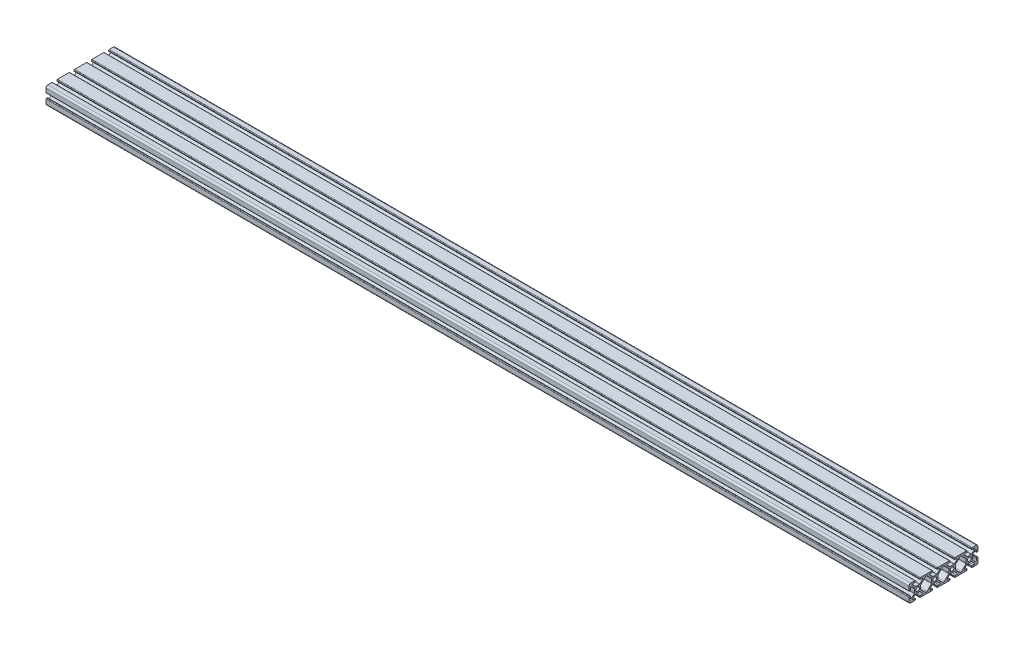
SolidWorks part; units mm, degrees
ref_plane "Ebene vorne" through (0, 0, 0) normal (0, 0, 1) x (1, 0, 0)
ref_plane "Ebene oben" through (0, 0, 0) normal (0, 1, 0) x (1, 0, 0)
ref_plane "Ebene rechts" through (0, 0, 0) normal (1, 0, 0) x (0, 0, -1)
sketch "Skizze3" plane through (0, 0, 0) normal (0, 1, 0) x (1, 0, 0)
  line L0 (0, 0) -> (1000, 0)
  dimension "D1" = 1000
other "Strukturbauteil1"
ref_plane "Ebene1" through (0, 0, 0) normal (1, 0, 0) x (0, 0, -1)
sketch "Model" plane through (0, 0, 0) normal (1, 0, 0) x (0, 0, -1)
  line L0 (-26.35, -2.0337) -> (-26.35, 2.0337)
  line L1 (-26.0571, 2.7408) -> (-21.0207, 7.7772)
  line L2 (-18.9793, 7.7772) -> (-13.9429, 2.7408)
  line L3 (-13.65, 2.0337) -> (-13.65, -2.0337)
  line L4 (-13.9429, -2.7408) -> (-18.9793, -7.7772)
  line L5 (-21.0207, -7.7772) -> (-26.0571, -2.7408)
  line L6 (-40, -3.2) -> (-40, -8)
  line L7 (-38, -10) -> (-33.2, -10)
  line L8 (-32.5, -9.3) -> (-32.5, -8.7)
  line L9 (-33, -8.2) -> (-34.8676, -8.2)
  line L10 (-35.4915, -6.6936) -> (-32.7408, -3.9429)
  line L11 (-32.0337, -3.65) -> (-27.9663, -3.65)
  line L12 (-27.2592, -3.9429) -> (-24.5085, -6.6936)
  line L13 (-25.1324, -8.2) -> (-27, -8.2)
  line L14 (-27.5, -8.7) -> (-27.5, -9.3)
  line L15 (-26.8, -10) -> (-13.2, -10)
  line L16 (-12.5, -9.3) -> (-12.5, -8.7)
  line L17 (-13, -8.2) -> (-14.8676, -8.2)
  line L18 (-15.4915, -6.6936) -> (-12.7408, -3.9429)
  line L19 (-12.0337, -3.65) -> (-7.9663, -3.65)
  line L20 (-7.2592, -3.9429) -> (-4.5085, -6.6936)
  line L21 (-5.1324, -8.2) -> (-7, -8.2)
  line L22 (-7.5, -8.7) -> (-7.5, -9.3)
  line L23 (-6.8, -10) -> (6.8, -10)
  line L24 (7.5, -9.3) -> (7.5, -8.7)
  line L25 (7, -8.2) -> (5.1324, -8.2)
  line L26 (4.5085, -6.6936) -> (7.2592, -3.9429)
  line L27 (7.9663, -3.65) -> (12.0337, -3.65)
  line L28 (12.7408, -3.9429) -> (15.4915, -6.6936)
  line L29 (14.8676, -8.2) -> (13, -8.2)
  line L30 (12.5, -8.7) -> (12.5, -9.3)
  line L31 (13.2, -10) -> (26.8, -10)
  line L32 (27.5, -9.3) -> (27.5, -8.7)
  line L33 (27, -8.2) -> (25.1324, -8.2)
  line L34 (24.5085, -6.6936) -> (27.2592, -3.9429)
  line L35 (27.9663, -3.65) -> (32.0337, -3.65)
  line L36 (32.7408, -3.9429) -> (35.4915, -6.6936)
  line L37 (34.8676, -8.2) -> (33, -8.2)
  line L38 (32.5, -8.7) -> (32.5, -9.3)
  line L39 (33.2, -10) -> (38, -10)
  line L40 (40, -8) -> (40, -3.2)
  line L41 (39.3, -2.5) -> (38.7, -2.5)
  line L42 (38.2, -3) -> (38.2, -4.8676)
  line L43 (36.6936, -5.4915) -> (33.9429, -2.7408)
  line L44 (33.65, -2.0337) -> (33.65, 2.0337)
  line L45 (33.9429, 2.7408) -> (36.6936, 5.4915)
  line L46 (38.2, 4.8676) -> (38.2, 3)
  line L47 (38.7, 2.5) -> (39.3, 2.5)
  line L48 (40, 3.2) -> (40, 8)
  line L49 (38, 10) -> (33.2, 10)
  line L50 (32.5, 9.3) -> (32.5, 8.7)
  line L51 (33, 8.2) -> (34.8676, 8.2)
  line L52 (35.4915, 6.6936) -> (32.7408, 3.9429)
  line L53 (32.0337, 3.65) -> (27.9663, 3.65)
  line L54 (27.2592, 3.9429) -> (24.5085, 6.6936)
  line L55 (25.1324, 8.2) -> (27, 8.2)
  line L56 (27.5, 8.7) -> (27.5, 9.3)
  line L57 (26.8, 10) -> (13.2, 10)
  line L58 (12.5, 9.3) -> (12.5, 8.7)
  line L59 (13, 8.2) -> (14.8676, 8.2)
  line L60 (15.4915, 6.6936) -> (12.7408, 3.9429)
  line L61 (12.0337, 3.65) -> (7.9663, 3.65)
  line L62 (7.2592, 3.9429) -> (4.5085, 6.6936)
  line L63 (5.1324, 8.2) -> (7, 8.2)
  line L64 (7.5, 8.7) -> (7.5, 9.3)
  line L65 (6.8, 10) -> (-6.8, 10)
  line L66 (-7.5, 9.3) -> (-7.5, 8.7)
  line L67 (-7, 8.2) -> (-5.1324, 8.2)
  line L68 (-4.5085, 6.6936) -> (-7.2592, 3.9429)
  line L69 (-7.9663, 3.65) -> (-12.0337, 3.65)
  line L70 (-12.7408, 3.9429) -> (-15.4915, 6.6936)
  line L71 (-14.8676, 8.2) -> (-13, 8.2)
  line L72 (-12.5, 8.7) -> (-12.5, 9.3)
  line L73 (-13.2, 10) -> (-26.8, 10)
  line L74 (-27.5, 9.3) -> (-27.5, 8.7)
  line L75 (-27, 8.2) -> (-25.1324, 8.2)
  line L76 (-24.5085, 6.6936) -> (-27.2592, 3.9429)
  line L77 (-27.9663, 3.65) -> (-32.0337, 3.65)
  line L78 (-32.7408, 3.9429) -> (-35.4915, 6.6936)
  line L79 (-34.8676, 8.2) -> (-33, 8.2)
  line L80 (-32.5, 8.7) -> (-32.5, 9.3)
  line L81 (-33.2, 10) -> (-38, 10)
  line L82 (-40, 8) -> (-40, 3.2)
  line L83 (-39.3, 2.5) -> (-38.7, 2.5)
  line L84 (-38.2, 3) -> (-38.2, 4.8676)
  line L85 (-36.6936, 5.4915) -> (-33.9429, 2.7408)
  line L86 (-33.65, 2.0337) -> (-33.65, -2.0337)
  line L87 (-33.9429, -2.7408) -> (-36.6936, -5.4915)
  line L88 (-38.2, -4.8676) -> (-38.2, -3)
  line L89 (-38.7, -2.5) -> (-39.3, -2.5)
  line L90 (13.65, -2.0337) -> (13.65, 2.0337)
  line L91 (13.9429, 2.7408) -> (18.9793, 7.7772)
  line L92 (21.0207, 7.7772) -> (26.0571, 2.7408)
  line L93 (26.35, 2.0337) -> (26.35, -2.0337)
  line L94 (26.0571, -2.7408) -> (21.0207, -7.7772)
  line L95 (18.9793, -7.7772) -> (13.9429, -2.7408)
  line L96 (-6.35, -2.0337) -> (-6.35, 2.0337)
  line L97 (-6.0571, 2.7408) -> (-1.0207, 7.7772)
  line L98 (1.0207, 7.7772) -> (6.0571, 2.7408)
  line L99 (6.35, 2.0337) -> (6.35, -2.0337)
  line L100 (6.0571, -2.7408) -> (1.0207, -7.7772)
  line L101 (-1.0207, -7.7772) -> (-6.0571, -2.7408)
  line L103 (-40, 10) -> (40, 10) construction
  line L104 (-40, 10) -> (-40, -10) construction
  line L105 (-40, -10) -> (40, -10) construction
  line L106 (40, 10) -> (40, -10) construction
  line L107 (-40, 10) -> (40, -10) construction
  line L108 (-40, -10) -> (40, 10) construction
  circle A0 centre (-30, 0) radius 2.15
  circle A1 centre (-10, 0) radius 2.15
  circle A2 centre (30, 0) radius 2.15
  circle A3 centre (10, 0) radius 2.15
  arc A4 (-26.35, -2.0337) -> (-26.0571, -2.7408) centre (-25.35, -2.0337) ccw
  arc A5 (-26.0571, 2.7408) -> (-26.35, 2.0337) centre (-25.35, 2.0337) ccw
  arc A6 (-18.9793, 7.7772) -> (-21.0207, 7.7772) centre (-20, 6.7565) ccw
  arc A7 (-13.65, 2.0337) -> (-13.9429, 2.7408) centre (-14.65, 2.0337) ccw
  arc A8 (-13.9429, -2.7408) -> (-13.65, -2.0337) centre (-14.65, -2.0337) ccw
  arc A9 (-21.0207, -7.7772) -> (-18.9793, -7.7772) centre (-20, -6.7565) ccw
  arc A10 (-40, -8) -> (-38, -10) centre (-38, -8) ccw
  arc A11 (-33.2, -10) -> (-32.5, -9.3) centre (-33.2, -9.3) ccw
  arc A12 (-32.5, -8.7) -> (-33, -8.2) centre (-33, -8.7) ccw
  arc A13 (-35.4915, -6.6936) -> (-34.8676, -8.2) centre (-34.8676, -7.3176) ccw
  arc A14 (-32.0337, -3.65) -> (-32.7408, -3.9429) centre (-32.0337, -4.65) ccw
  arc A15 (-27.2592, -3.9429) -> (-27.9663, -3.65) centre (-27.9663, -4.65) ccw
  arc A16 (-25.1324, -8.2) -> (-24.5085, -6.6936) centre (-25.1324, -7.3176) ccw
  arc A17 (-27, -8.2) -> (-27.5, -8.7) centre (-27, -8.7) ccw
  arc A18 (-27.5, -9.3) -> (-26.8, -10) centre (-26.8, -9.3) ccw
  arc A19 (-13.2, -10) -> (-12.5, -9.3) centre (-13.2, -9.3) ccw
  arc A20 (-12.5, -8.7) -> (-13, -8.2) centre (-13, -8.7) ccw
  arc A21 (-15.4915, -6.6936) -> (-14.8676, -8.2) centre (-14.8676, -7.3176) ccw
  arc A22 (-12.0337, -3.65) -> (-12.7408, -3.9429) centre (-12.0337, -4.65) ccw
  arc A23 (-7.2592, -3.9429) -> (-7.9663, -3.65) centre (-7.9663, -4.65) ccw
  arc A24 (-5.1324, -8.2) -> (-4.5085, -6.6936) centre (-5.1324, -7.3176) ccw
  arc A25 (-7, -8.2) -> (-7.5, -8.7) centre (-7, -8.7) ccw
  arc A26 (-7.5, -9.3) -> (-6.8, -10) centre (-6.8, -9.3) ccw
  arc A27 (6.8, -10) -> (7.5, -9.3) centre (6.8, -9.3) ccw
  arc A28 (7.5, -8.7) -> (7, -8.2) centre (7, -8.7) ccw
  arc A29 (4.5085, -6.6936) -> (5.1324, -8.2) centre (5.1324, -7.3176) ccw
  arc A30 (7.9663, -3.65) -> (7.2592, -3.9429) centre (7.9663, -4.65) ccw
  arc A31 (12.7408, -3.9429) -> (12.0337, -3.65) centre (12.0337, -4.65) ccw
  arc A32 (14.8676, -8.2) -> (15.4915, -6.6936) centre (14.8676, -7.3176) ccw
  arc A33 (13, -8.2) -> (12.5, -8.7) centre (13, -8.7) ccw
  arc A34 (12.5, -9.3) -> (13.2, -10) centre (13.2, -9.3) ccw
  arc A35 (26.8, -10) -> (27.5, -9.3) centre (26.8, -9.3) ccw
  arc A36 (27.5, -8.7) -> (27, -8.2) centre (27, -8.7) ccw
  arc A37 (24.5085, -6.6936) -> (25.1324, -8.2) centre (25.1324, -7.3176) ccw
  arc A38 (27.9663, -3.65) -> (27.2592, -3.9429) centre (27.9663, -4.65) ccw
  arc A39 (32.7408, -3.9429) -> (32.0337, -3.65) centre (32.0337, -4.65) ccw
  arc A40 (34.8676, -8.2) -> (35.4915, -6.6936) centre (34.8676, -7.3176) ccw
  arc A41 (33, -8.2) -> (32.5, -8.7) centre (33, -8.7) ccw
  arc A42 (32.5, -9.3) -> (33.2, -10) centre (33.2, -9.3) ccw
  arc A43 (38, -10) -> (40, -8) centre (38, -8) ccw
  arc A44 (40, -3.2) -> (39.3, -2.5) centre (39.3, -3.2) ccw
  arc A45 (38.7, -2.5) -> (38.2, -3) centre (38.7, -3) ccw
  arc A46 (36.6936, -5.4915) -> (38.2, -4.8676) centre (37.3176, -4.8676) ccw
  arc A47 (33.65, -2.0337) -> (33.9429, -2.7408) centre (34.65, -2.0337) ccw
  arc A48 (33.9429, 2.7408) -> (33.65, 2.0337) centre (34.65, 2.0337) ccw
  arc A49 (38.2, 4.8676) -> (36.6936, 5.4915) centre (37.3176, 4.8676) ccw
  arc A50 (38.2, 3) -> (38.7, 2.5) centre (38.7, 3) ccw
  arc A51 (39.3, 2.5) -> (40, 3.2) centre (39.3, 3.2) ccw
  arc A52 (40, 8) -> (38, 10) centre (38, 8) ccw
  arc A53 (33.2, 10) -> (32.5, 9.3) centre (33.2, 9.3) ccw
  arc A54 (32.5, 8.7) -> (33, 8.2) centre (33, 8.7) ccw
  arc A55 (35.4915, 6.6936) -> (34.8676, 8.2) centre (34.8676, 7.3176) ccw
  arc A56 (32.0337, 3.65) -> (32.7408, 3.9429) centre (32.0337, 4.65) ccw
  arc A57 (27.2592, 3.9429) -> (27.9663, 3.65) centre (27.9663, 4.65) ccw
  arc A58 (25.1324, 8.2) -> (24.5085, 6.6936) centre (25.1324, 7.3176) ccw
  arc A59 (27, 8.2) -> (27.5, 8.7) centre (27, 8.7) ccw
  arc A60 (27.5, 9.3) -> (26.8, 10) centre (26.8, 9.3) ccw
  arc A61 (13.2, 10) -> (12.5, 9.3) centre (13.2, 9.3) ccw
  arc A62 (12.5, 8.7) -> (13, 8.2) centre (13, 8.7) ccw
  arc A63 (15.4915, 6.6936) -> (14.8676, 8.2) centre (14.8676, 7.3176) ccw
  arc A64 (12.0337, 3.65) -> (12.7408, 3.9429) centre (12.0337, 4.65) ccw
  arc A65 (7.2592, 3.9429) -> (7.9663, 3.65) centre (7.9663, 4.65) ccw
  arc A66 (5.1324, 8.2) -> (4.5085, 6.6936) centre (5.1324, 7.3176) ccw
  arc A67 (7, 8.2) -> (7.5, 8.7) centre (7, 8.7) ccw
  arc A68 (7.5, 9.3) -> (6.8, 10) centre (6.8, 9.3) ccw
  arc A69 (-6.8, 10) -> (-7.5, 9.3) centre (-6.8, 9.3) ccw
  arc A70 (-7.5, 8.7) -> (-7, 8.2) centre (-7, 8.7) ccw
  arc A71 (-4.5085, 6.6936) -> (-5.1324, 8.2) centre (-5.1324, 7.3176) ccw
  arc A72 (-7.9663, 3.65) -> (-7.2592, 3.9429) centre (-7.9663, 4.65) ccw
  arc A73 (-12.7408, 3.9429) -> (-12.0337, 3.65) centre (-12.0337, 4.65) ccw
  arc A74 (-14.8676, 8.2) -> (-15.4915, 6.6936) centre (-14.8676, 7.3176) ccw
  arc A75 (-13, 8.2) -> (-12.5, 8.7) centre (-13, 8.7) ccw
  arc A76 (-12.5, 9.3) -> (-13.2, 10) centre (-13.2, 9.3) ccw
  arc A77 (-26.8, 10) -> (-27.5, 9.3) centre (-26.8, 9.3) ccw
  arc A78 (-27.5, 8.7) -> (-27, 8.2) centre (-27, 8.7) ccw
  arc A79 (-24.5085, 6.6936) -> (-25.1324, 8.2) centre (-25.1324, 7.3176) ccw
  arc A80 (-27.9663, 3.65) -> (-27.2592, 3.9429) centre (-27.9663, 4.65) ccw
  arc A81 (-32.7408, 3.9429) -> (-32.0337, 3.65) centre (-32.0337, 4.65) ccw
  arc A82 (-34.8676, 8.2) -> (-35.4915, 6.6936) centre (-34.8676, 7.3176) ccw
  arc A83 (-33, 8.2) -> (-32.5, 8.7) centre (-33, 8.7) ccw
  arc A84 (-32.5, 9.3) -> (-33.2, 10) centre (-33.2, 9.3) ccw
  arc A85 (-38, 10) -> (-40, 8) centre (-38, 8) ccw
  arc A86 (-40, 3.2) -> (-39.3, 2.5) centre (-39.3, 3.2) ccw
  arc A87 (-38.7, 2.5) -> (-38.2, 3) centre (-38.7, 3) ccw
  arc A88 (-36.6936, 5.4915) -> (-38.2, 4.8676) centre (-37.3176, 4.8676) ccw
  arc A89 (-33.65, 2.0337) -> (-33.9429, 2.7408) centre (-34.65, 2.0337) ccw
  arc A90 (-33.9429, -2.7408) -> (-33.65, -2.0337) centre (-34.65, -2.0337) ccw
  arc A91 (-38.2, -4.8676) -> (-36.6936, -5.4915) centre (-37.3176, -4.8676) ccw
  arc A92 (-38.2, -3) -> (-38.7, -2.5) centre (-38.7, -3) ccw
  arc A93 (-39.3, -2.5) -> (-40, -3.2) centre (-39.3, -3.2) ccw
  arc A94 (13.65, -2.0337) -> (13.9429, -2.7408) centre (14.65, -2.0337) ccw
  arc A95 (13.9429, 2.7408) -> (13.65, 2.0337) centre (14.65, 2.0337) ccw
  arc A96 (21.0207, 7.7772) -> (18.9793, 7.7772) centre (20, 6.7565) ccw
  arc A97 (26.35, 2.0337) -> (26.0571, 2.7408) centre (25.35, 2.0337) ccw
  arc A98 (26.0571, -2.7408) -> (26.35, -2.0337) centre (25.35, -2.0337) ccw
  arc A99 (18.9793, -7.7772) -> (21.0207, -7.7772) centre (20, -6.7565) ccw
  arc A100 (-6.35, -2.0337) -> (-6.0571, -2.7408) centre (-5.35, -2.0337) ccw
  arc A101 (-6.0571, 2.7408) -> (-6.35, 2.0337) centre (-5.35, 2.0337) ccw
  arc A102 (1.0207, 7.7772) -> (-1.0207, 7.7772) centre (0, 6.7565) ccw
  arc A103 (6.35, 2.0337) -> (6.0571, 2.7408) centre (5.35, 2.0337) ccw
  arc A104 (6.0571, -2.7408) -> (6.35, -2.0337) centre (5.35, -2.0337) ccw
  arc A105 (-1.0207, -7.7772) -> (1.0207, -7.7772) centre (0, -6.7565) ccw
  point P314 (0, 0)
  point P320 (-40, 0)
  point P321 (-30, 10)
  point P322 (-30, -10)
  point P323 (-10, -10)
  point P324 (-10, 10)
  point P325 (10, 10)
  point P326 (10, -10)
  point P327 (30, -10)
  point P328 (30, 10)
  point P329 (40, 0)
  point P330 (0, 0)
